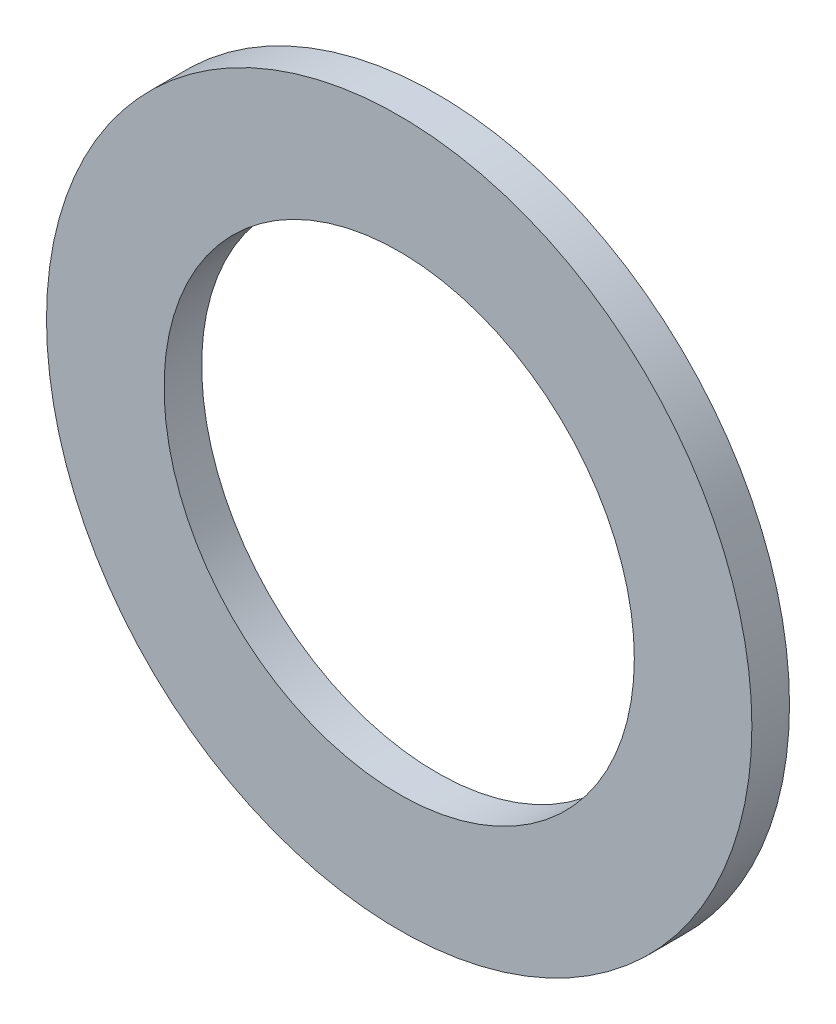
SolidWorks part; units mm, degrees
ref_plane "Front" through (0, 0, 0) normal (0, 0, 1) x (1, 0, 0)
ref_plane "Top" through (0, 0, 0) normal (0, 1, 0) x (1, 0, 0)
ref_plane "Right" through (0, 0, 0) normal (1, 0, 0) x (0, 0, -1)
sketch "Sketch1" plane through (0, 0, 0) normal (0, 0, 1) x (1, 0, 0)
  circle A0 centre (0, 0) radius 1.5875
  circle A1 centre (0, 0) radius 2.3813
extrude "Boss-Extrude1" add sketch "Sketch1" along normal blind 0.254
